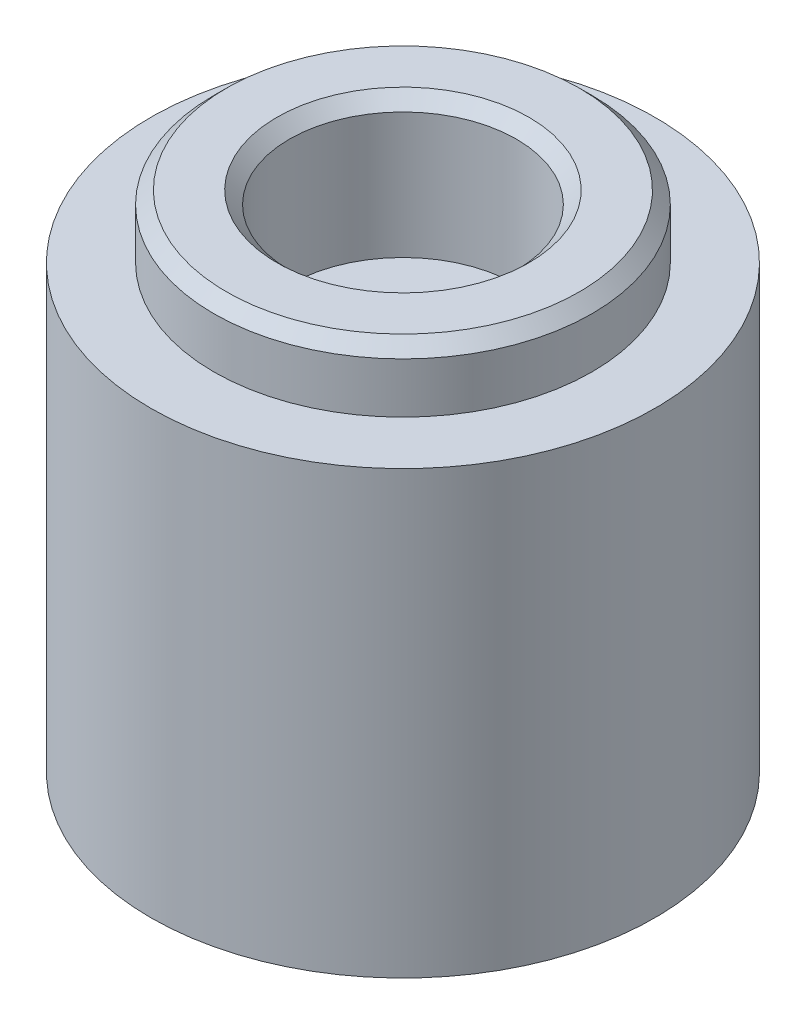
SolidWorks part; units mm, degrees
ref_plane "Plan1" through (0, 0, 0) normal (0, 0, 1) x (1, 0, 0)
ref_plane "Plan2" through (0, 0, 0) normal (0, 1, 0) x (1, 0, 0)
ref_plane "Plan3" through (0, 0, 0) normal (1, 0, 0) x (0, 0, -1)
sketch "Esquisse1" plane through (0, 0, 0) normal (0, 0, 1) x (1, 0, 0)
  line L0 (0, 30) -> (0, -20) construction
  line L1 (5.5, 35) -> (5.5, 0)
  line L2 (9, 46) -> (15, 46)
  line L3 (15, 46) -> (15, 41)
  line L4 (15, 41) -> (20, 41)
  line L5 (20, 41) -> (20, 6)
  line L6 (20, 6) -> (9, 6)
  line L7 (9, 6) -> (9, 0)
  line L8 (9, 0) -> (5.5, 0)
  line L9 (9, 46) -> (9, 35)
  line L10 (9, 35) -> (5.5, 35)
  dimension "D1" = 9
  dimension "D2" = 15
  dimension "D3" = 20
  dimension "D4" = 9
  dimension "D5" = 6
  dimension "D6" = 35
  dimension "D7" = 11
  dimension "D8" = 40
  dimension "D9" = 5.5
revolve "Base-Révolution" add sketch "Esquisse1" angle 360 about L0
chamfer "Chanfrein1" distance 1 angle 45
